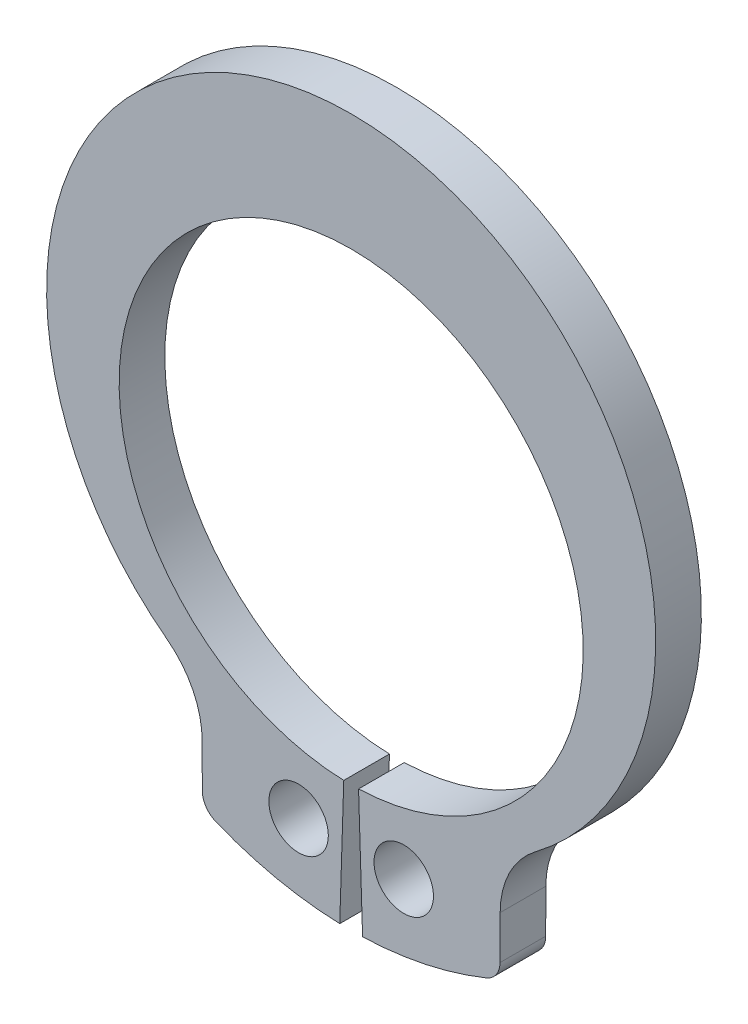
SolidWorks part; units mm, degrees
ref_plane "Plane1" through (0, 0, 0) normal (0, 0, 1) x (1, 0, 0)
ref_plane "Plane2" through (0, 0, 0) normal (0, 1, 0) x (1, 0, 0)
ref_plane "Plane3" through (0, 0, 0) normal (1, 0, 0) x (0, 0, -1)
sketch "Clipboard" plane through (0, 0, 0) normal (0, 0, 1) x (1, 0, 0)
  line L0 (0, 0) -> (1.016, 0)
  line L1 (0, 0) -> (0, 0.6604)
  line L2 (0, 0) -> (0, -2.2098)
  circle A0 centre (0, 0) radius 0.5207
  circle A1 centre (0, 0) radius 3.9624
  dimension "HoleDia" = 1.0414
  dimension "ShaftDia" = 7.9248
  dimension "LargeSection" = 1.016
  dimension "SmallSection" = 0.6604
  dimension "LugSection" = 2.2098
sketch "BodySke" plane through (0, 0, 0) normal (0, 0, 1) x (1, 0, 0)
  line L0 (-1.5431, 0) -> (1.5431, 0) construction
  line L1 (0, 0) -> (0, 6.1139) construction
  line L2 (0.1296, -4.0619) -> (0.2, -6.2706)
  line L3 (-0.1296, -4.0619) -> (-0.2, -6.2706)
  line L4 (0, 0) -> (4.1533, -4.7022) construction
  line L5 (0, 0) -> (-4.1533, -4.7022) construction
  line L7 (2.6096, -4.6979) -> (2.6075, -5.4571)
  line L8 (-2.6096, -4.6979) -> (-2.6075, -5.4571)
  circle A0 centre (0, 0) radius 4.064 construction
  arc A1 (0.1296, -4.0619) -> (-0.1296, -4.0619) centre (0, 0) ccw
  arc A2 (3.1276, -3.5409) -> (-3.1276, -3.5409) centre (0, 0.7799) ccw construction
  arc A3 (0.2, -6.2706) -> (2.3704, -5.8088) centre (0, 0) ccw
  arc A4 (3.2211, -3.4717) -> (2.6096, -4.6979) centre (4.1533, -4.7022) ccw
  arc A5 (-2.6096, -4.6979) -> (-3.2211, -3.4717) centre (-4.1533, -4.7022) ccw
  arc A6 (-2.3704, -5.8088) -> (-0.2, -6.2706) centre (0, 0) ccw
  arc A7 (3.2211, -3.4717) -> (-3.2211, -3.4717) centre (0, 0.7799) ccw
  arc A8 (-2.6104, -4.4024) -> (2.6104, -4.4024) centre (0, 0) ccw construction
  circle A9 centre (0.9207, -5.0346) radius 0.5207
  circle A10 centre (-0.9207, -5.0346) radius 0.5207
  arc A11 (2.6075, -5.4571) -> (2.3704, -5.8088) centre (2.2265, -5.456) cw
  arc A12 (-2.6075, -5.4571) -> (-2.3704, -5.8088) centre (-2.2265, -5.456) ccw
  point P28 (2.6068, -5.7066)
  point P31 (-2.6068, -5.7066)
  dimension "D1" = 5.334
  dimension "GrooveDia" = 8.128
  dimension "D3" = 0.381
  dimension "LugRad" = 6.2738
  dimension "HoleOffsetRad" = 5.1181
  dimension "HoleDia" = 1.0414
  dimension "D2" = 0.32
  dimension "SmallRad" = 4.7244
  dimension "Gap" = 0.4
  dimension "SmallAngle" = 82.907
  dimension "HoleSpacing" = 1.8414
extrude "Body" add sketch "BodySke" against normal blind 0.8
sketch "NotSke" plane through (0, 0, 0) normal (0, 0, 1) x (1, 0, 0)
  line L0 (0.9207, -4.5139) -> (0.9207, -5.5553)
  line L1 (0.9207, -5.5553) -> (-0.9207, -5.5553)
  line L2 (-0.9207, -5.5553) -> (-0.9207, -4.5139)
  line L3 (-0.9207, -4.5139) -> (0.9207, -4.5139)
  circle A0 centre (0.9207, -5.0346) radius 0.5207 construction
  circle A1 centre (-0.9207, -5.0346) radius 0.5207 construction
extrude "Notch" [suppressed] cut sketch "NotSke" against normal through all
equation "' \"ShaftDia@Clipboard\" = 0.125"
equation "' \"Thickness@Body\" = 0.01"
equation "' \"GrooveDia@BodySke\" = 0.117"
equation "' \"LugSection@Clipboard\" = 0.046"
equation "' \"LargeSection@Clipboard\" = 0.018"
equation "' \"SmallSection@Clipboard\" = 0.011"
equation "' \"HoleDia@Clipboard\" = 0.026"
equation "' \"ShaftDia@Clipboard\" = 0.394"
equation "' \"Thickness@Body\" = 0.025"
equation "' \"GrooveDia@BodySke\" = 0.369"
equation "' \"LugSection@Clipboard\" = 0.087"
equation "' \"LargeSection@Clipboard\" = 0.052"
equation "' \"SmallSection@Clipboard\" = 0.031"
equation "' \"HoleDia@Clipboard\" = 0.041"
equation "\"Gap@BodySke\" =  \"Thickness@Body\" / 2"
equation "\"SmallRad@BodySke\" =  \"GrooveDia@BodySke\" / 2 +  \"SmallSection@Clipboard\""
equation "\"LugRad@BodySke\" = \"GrooveDia@BodySke\" / 2 + \"LugSection@Clipboard\""
equation "\"HoleOffsetRad@BodySke\" = (  \"ShaftDia@Clipboard\" / 2 + \"LugRad@BodySke\" ) / 2"
equation "\"HoleSpacing@BodySke\" = \"Gap@BodySke\"  * 2 +  \"HoleDia@Clipboard\""
equation "\"HoleDia@BodySke\" =  \"HoleDia@Clipboard\""
equation "\"SmallAngle@BodySke\" = atn(\"HoleSpacing@BodySke\" / 2 / sqr(\"HoleOffsetRad@BodySke\"  * \"HoleOffsetRad@BodySke\" - (\"HoleSpacing@BodySke\" / 2) * (\"HoleSpacing@BodySke\" / 2) ))  * 8 * ( 180 / 3.141593)"
